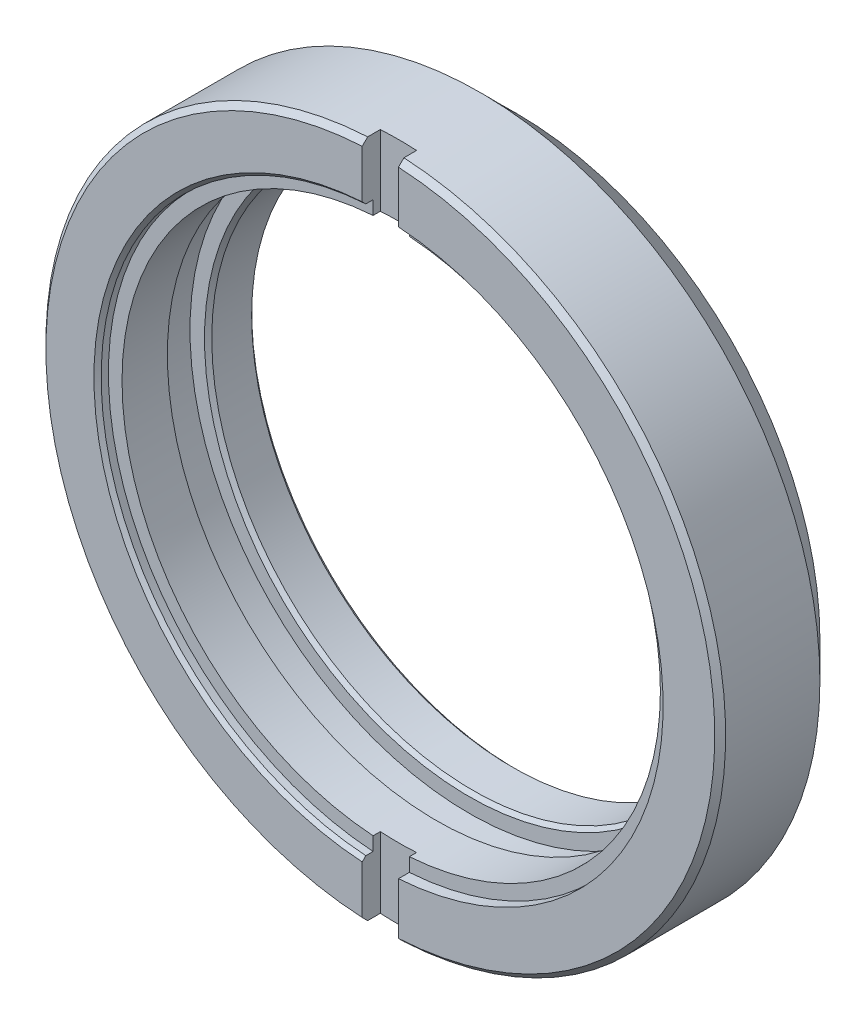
SolidWorks part; units mm, degrees
ref_plane "Front Plane" through (0, 0, 0) normal (0, 0, 1) x (1, 0, 0)
ref_plane "Top Plane" through (0, 0, 0) normal (0, 1, 0) x (1, 0, 0)
ref_plane "Right Plane" through (0, 0, 0) normal (1, 0, 0) x (0, 0, -1)
sketch "Sketch1" plane through (0, 0, 0) normal (0, 0, 1) x (1, 0, 0)
  circle A0 centre (0, 0) radius 23.8125
  dimension "D1" = 47.625
extrude "bar" add sketch "Sketch1" along normal blind 9.525
sketch "Sketch2" plane through (0, 0, 9.525) normal (0, 0, 1) x (1, 0, 0)
  circle A0 centre (0, 0) radius 19.812
  dimension "D1" = 39.624
extrude "sbe c bore" cut sketch "Sketch2" against normal blind 0.762
sketch "Sketch4" plane through (0, 0, 8.763) normal (0, 0, 1) x (1, 0, 0)
  circle A0 centre (0, 0) radius 18.8595
  dimension "D1" = 37.719
extrude "sbe pump thread" cut sketch "Sketch4" against normal blind 5.461
sketch "Sketch5" plane through (0, 0, 3.302) normal (0, 0, 1) x (1, 0, 0)
  circle A0 centre (0, 0) radius 18.288
  dimension "D1" = 36.576
extrude "sbe oring bore" cut sketch "Sketch5" against normal through all
ref_plane "Plane1" through (0, 0, 0) normal (-1, 0, 0) x (0, 1, 0)
ref_plane "Plane2" through (0, 0, 0) normal (-1, 0, 0) x (0, 1, 0)
ref_plane "Plane3" through (0, 0, 0) normal (-1, 0, 0) x (0, 1, 0)
ref_plane "Plane4" through (0, 0, 9.525) normal (-1, 0, 0) x (0, 1, 0)
chamfer "Chamfer2" distance 0.381 angle 45 1 edges at (23.8125, 0, 9.525)
sketch "Sketch6" plane through (0, 0, 9.525) normal (0, 0, 1) x (1, 0, 0)
  line L0 (0, 0) -> (0, 25.5469) construction
  line L2 (-1.27, 25.4) -> (1.27, 25.4)
  line L3 (-1.27, 25.4) -> (-1.27, -25.4)
  line L4 (-1.27, -25.4) -> (1.27, -25.4)
  line L5 (1.27, 25.4) -> (1.27, -25.4)
  dimension "D1" = 2.54
  dimension "D2" = 1.27
  dimension "D3" = 50.8
  dimension "D4" = 25.4
extrude "drive slots" cut sketch "Sketch6" against normal blind 1.27
ref_plane "Plane5" through (0, 0, 0) normal (-1, 0, 0) x (0, 1, 0)
ref_plane "Plane6" through (0, 0, 0) normal (-1, 0, 0) x (0, 1, 0)
ref_plane "Plane7" through (0, 0, 0) normal (-1, 0, 0) x (0, 1, 0)
chamfer "oring chamfer" distance 2.54 angle 45 1 edges at (23.8125, 0, 0)
sketch "Sketch7" plane through (0, 0, 3.302) normal (0, 0, 1) x (1, 0, 0)
  circle A0 centre (0, 0) radius 19.558
  dimension "D1" = 39.116
extrude "thread relif" cut sketch "Sketch7" along normal blind 2.286
chamfer "Chamfer4" distance 0.254 angle 45 3 edges at (18.288, 0, 3.302) (18.288, 0, 0) (-19.812, 0, 9.525)
